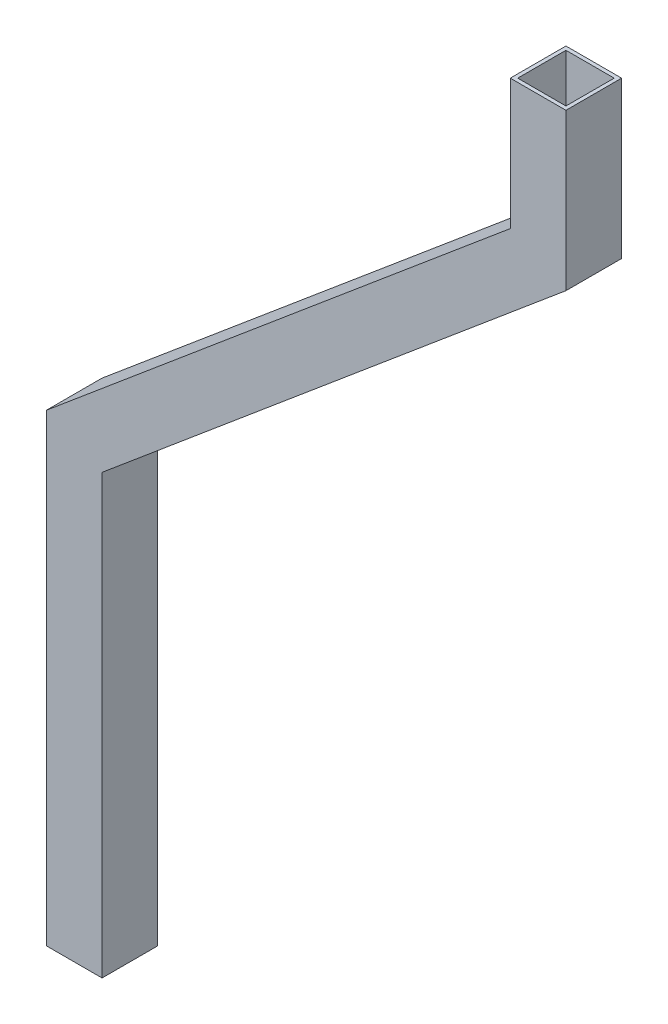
SolidWorks part; units mm, degrees
ref_plane "Piano frontale" through (0, 0, 0) normal (0, 0, 1) x (1, 0, 0)
ref_plane "Piano superiore" through (0, 0, 0) normal (0, 1, 0) x (1, 0, 0)
ref_plane "Piano destro" through (0, 0, 0) normal (1, 0, 0) x (0, 0, -1)
sketch "Schizzo1" plane through (0, 0, 0) normal (0, 0, 1) x (1, 0, 0)
  line L0 (0, 0) -> (0, 250)
  line L1 (0, 250) -> (250, 459.7749)
  line L2 (250, 459.7749) -> (250, 530)
  dimension "D1" = 250
  dimension "D2" = 50
  dimension "D3" = 530
  dimension "D4" = 250
ref_plane "Piano1" through (0, 0, 0) normal (0, 1, 0) x (1, 0, 0)
sketch "Schizzo3" plane through (0, 0, 0) normal (0, 1, 0) x (1, 0, 0)
  line L1 (0, 0) -> (30, 0)
  line L2 (0, 0) -> (0, -30)
  line L3 (0, -30) -> (30, -30)
  line L4 (30, 0) -> (30, -30)
  dimension "D1" = 30
  dimension "D2" = 30
sweep "Sweep-Sottile1" add profiles "Schizzo3" path "Schizzo1" parameters "D1"=2
sketch "Schizzo5" plane through (0, 0, 0) normal (0, 1, 0) x (1, 0, 0)
  line L0 (280, 0) -> (280, -30) construction
  line L1 (280, 0) -> (280, -30) construction
  line L3 (280, -30) -> (250, -30)
  line L4 (280, -30) -> (280, 0)
  line L5 (280, 0) -> (250, 0)
  line L6 (250, -30) -> (250, 0)
